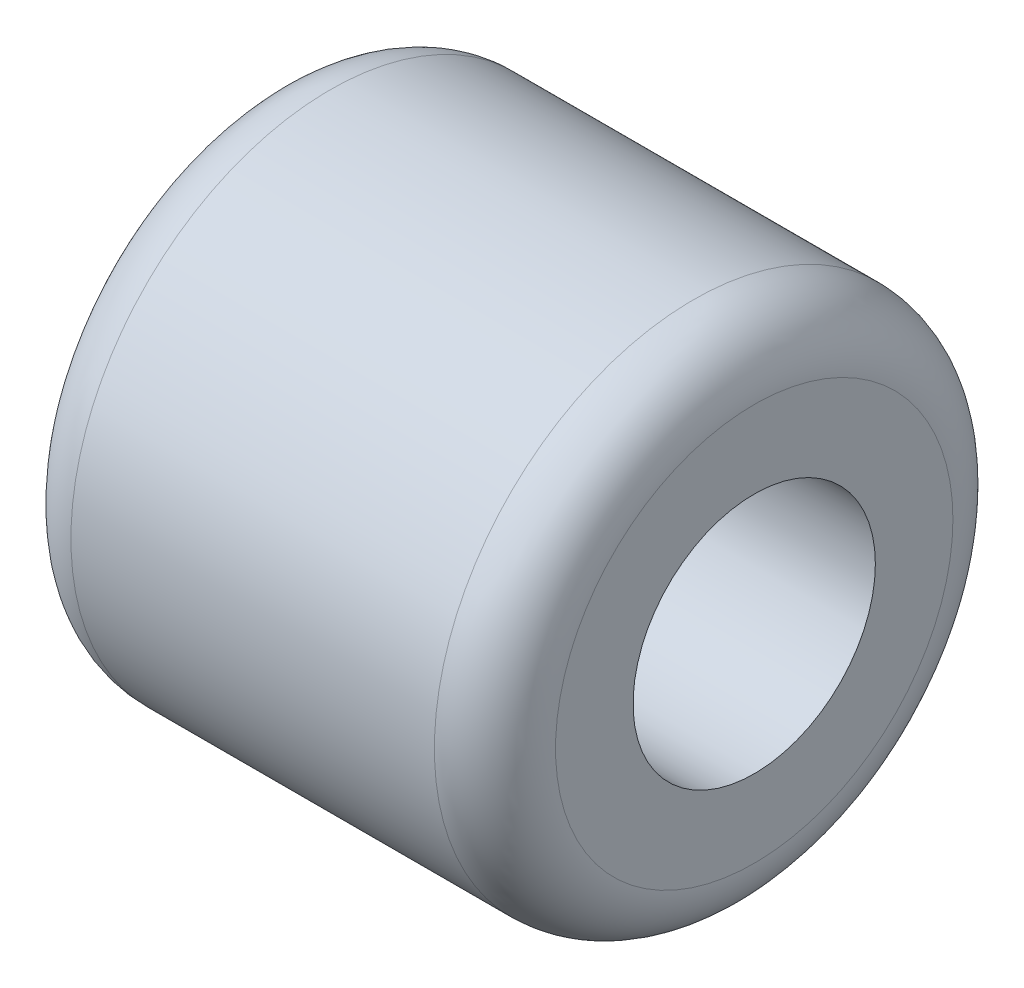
SolidWorks part; units mm, degrees
ref_plane "Front Plane" through (0, 0, 0) normal (0, 0, 1) x (1, 0, 0)
ref_plane "Top Plane" through (0, 0, 0) normal (0, 1, 0) x (1, 0, 0)
ref_plane "Right Plane" through (0, 0, 0) normal (1, 0, 0) x (0, 0, -1)
sketch "Sketch1" plane through (0, 0, 0) normal (1, 0, 0) x (0, 0, -1)
  circle A0 centre (0, 0) radius 5.4356
  circle A1 centre (0, 0) radius 2.54
  dimension "D1" = 10.8712
  dimension "D2" = 5.08
extrude "Extrude1" add sketch "Sketch1" along normal mid plane 10.16
fillet "Fillet1" radius 1.27 2 edges at (-5.08, 0, -5.4356) (5.08, 0, -5.4356)
